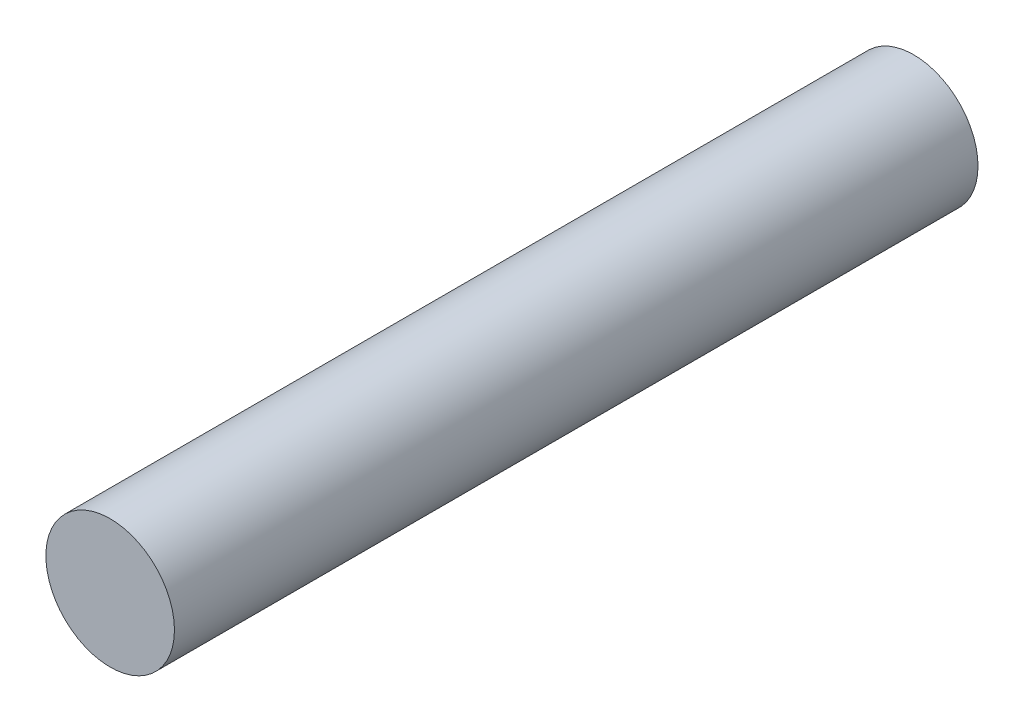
SolidWorks part; units mm, degrees
ref_plane "正面" through (0, 0, 0) normal (0, 0, 1) x (1, 0, 0)
ref_plane "平面" through (0, 0, 0) normal (0, 1, 0) x (1, 0, 0)
ref_plane "右側面" through (0, 0, 0) normal (1, 0, 0) x (0, 0, -1)
sketch "ｽｹｯﾁ1" plane through (0, 0, 0) normal (0, 0, 1) x (1, 0, 0)
  circle A0 centre (0, 0) radius 4
  dimension "D1" = 8
extrude "押し出し1" add sketch "ｽｹｯﾁ1" along normal blind 50
